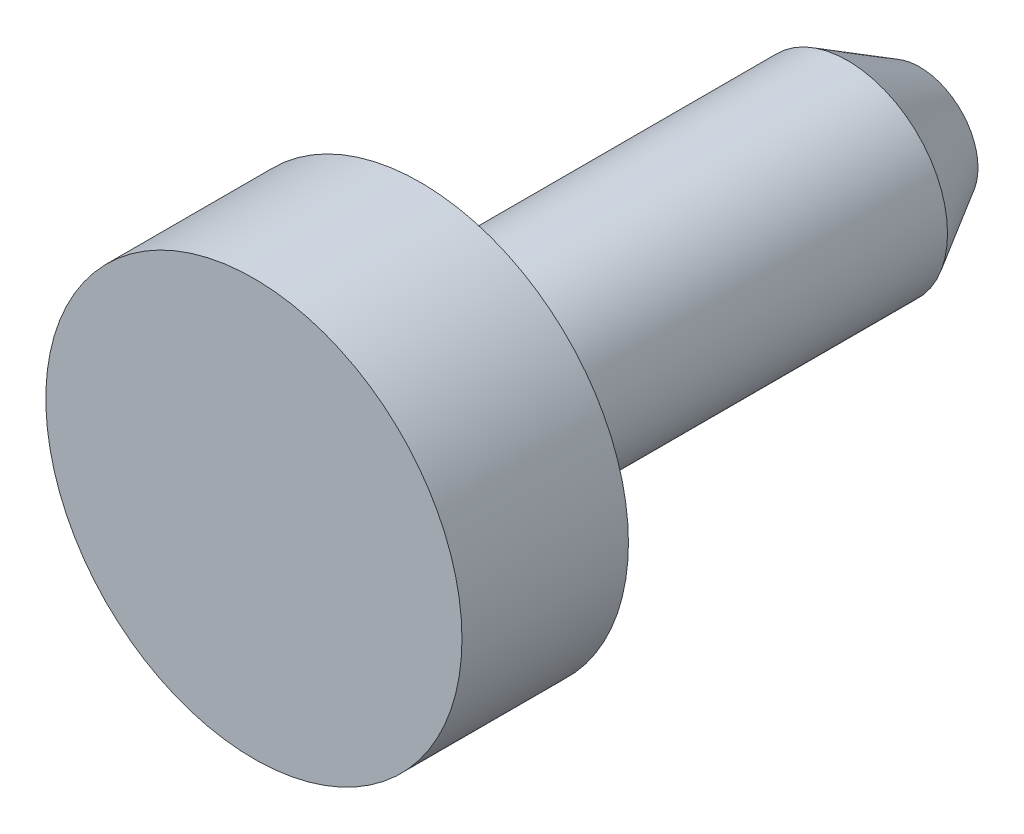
SolidWorks part; units mm, degrees
ref_plane "Alzado" through (0, 0, 0) normal (0, 0, 1) x (1, 0, 0)
ref_plane "Planta" through (0, 0, 0) normal (0, 1, 0) x (1, 0, 0)
ref_plane "Vista lateral" through (0, 0, 0) normal (1, 0, 0) x (0, 0, -1)
sketch "Croquis1" plane through (0, 0, 0) normal (0, 0, 1) x (1, 0, 0)
  circle A0 centre (0, 0) radius 2.5
  dimension "D1" = 5
extrude "Saliente-Extruir1" add sketch "Croquis1" along normal blind 2
sketch "Croquis2" plane through (0, 0, 0) normal (0, 0, 1) x (1, 0, 0)
  circle A0 centre (0, 0) radius 1.2
  dimension "D1" = 2.4
extrude "Saliente-Extruir2" add sketch "Croquis2" against normal blind 6
chamfer "Chaflán1" distance 0.5 angle 60 1 edges at (1.2, 0, -6)
